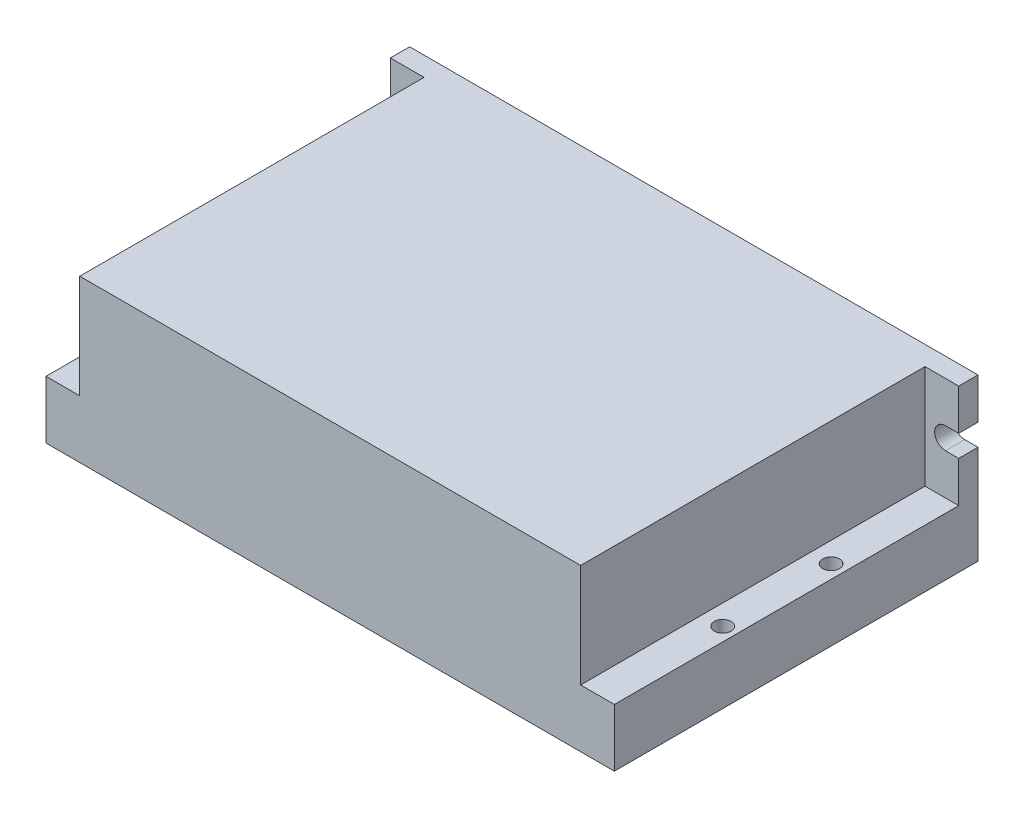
SolidWorks part; units mm, degrees
ref_plane "前视" through (0, 0, 0) normal (0, 0, 1) x (1, 0, 0)
ref_plane "上视" through (0, 0, 0) normal (0, 1, 0) x (1, 0, 0)
ref_plane "右视" through (0, 0, 0) normal (1, 0, 0) x (0, 0, -1)
sketch "草图1" plane through (0, 0, 0) normal (0, 1, 0) x (1, 0, 0)
  line L1 (0, 0) -> (118, 0)
  line L2 (0, 0) -> (0, 75.5)
  line L3 (0, 75.5) -> (118, 75.5)
  line L4 (118, 0) -> (118, 75.5)
extrude "凸台-拉伸1" add sketch "草图1" along normal blind 33.5
sketch "草图2" plane through (0, 0, 0) normal (0, 0, 1) x (1, 0, 0)
  line L1 (0, 33.5) -> (7, 33.5)
  line L2 (0, 33.5) -> (0, 12)
  line L3 (0, 12) -> (7, 12)
  line L4 (7, 33.5) -> (7, 12)
  line L5 (118, 33.5) -> (111, 33.5)
  line L6 (118, 33.5) -> (118, 12)
  line L7 (118, 12) -> (111, 12)
  line L8 (111, 33.5) -> (111, 12)
extrude "切除-拉伸1" cut sketch "草图2" against normal blind 71.5
ref_plane "基准面1" through (0, 0, -71.5) normal (0, 0, 1) x (1, 0, 0)
sketch "草图3" plane through (0, 0, -71.5) normal (0, 0, 1) x (1, 0, 0)
  line L0 (115.25, 25) -> (118, 25)
  line L3 (118, 12) -> (118, 33.5) construction
  line L4 (118, 25) -> (118, 20.5)
  line L5 (118, 20.5) -> (115.25, 20.5)
  line L6 (2.75, 25) -> (0, 25)
  line L7 (0, 33.5) -> (0, 12) construction
  line L8 (0, 25) -> (0, 20.5)
  line L9 (0, 20.5) -> (2.75, 20.5)
  arc A0 (115.25, 25) -> (115.25, 20.5) centre (115.25, 22.75) ccw
  arc A1 (2.75, 25) -> (2.75, 20.5) centre (2.75, 22.75) cw
extrude "切除-拉伸2" cut sketch "草图3" against normal blind 4
ref_plane "基准面2" through (0, 12, 0) normal (0, 1, 0) x (1, 0, 0)
sketch "草图5" plane through (0, 12, 0) normal (0, 1, 0) x (1, 0, 0)
  circle A0 centre (115.2, 47.8) radius 1.75
  circle A1 centre (115.2, 25.3) radius 1.75
  circle A2 centre (2.8, 25.3) radius 1.75
  circle A3 centre (2.8, 47.8) radius 1.75
extrude "切除-拉伸3" cut sketch "草图5" against normal blind 12
